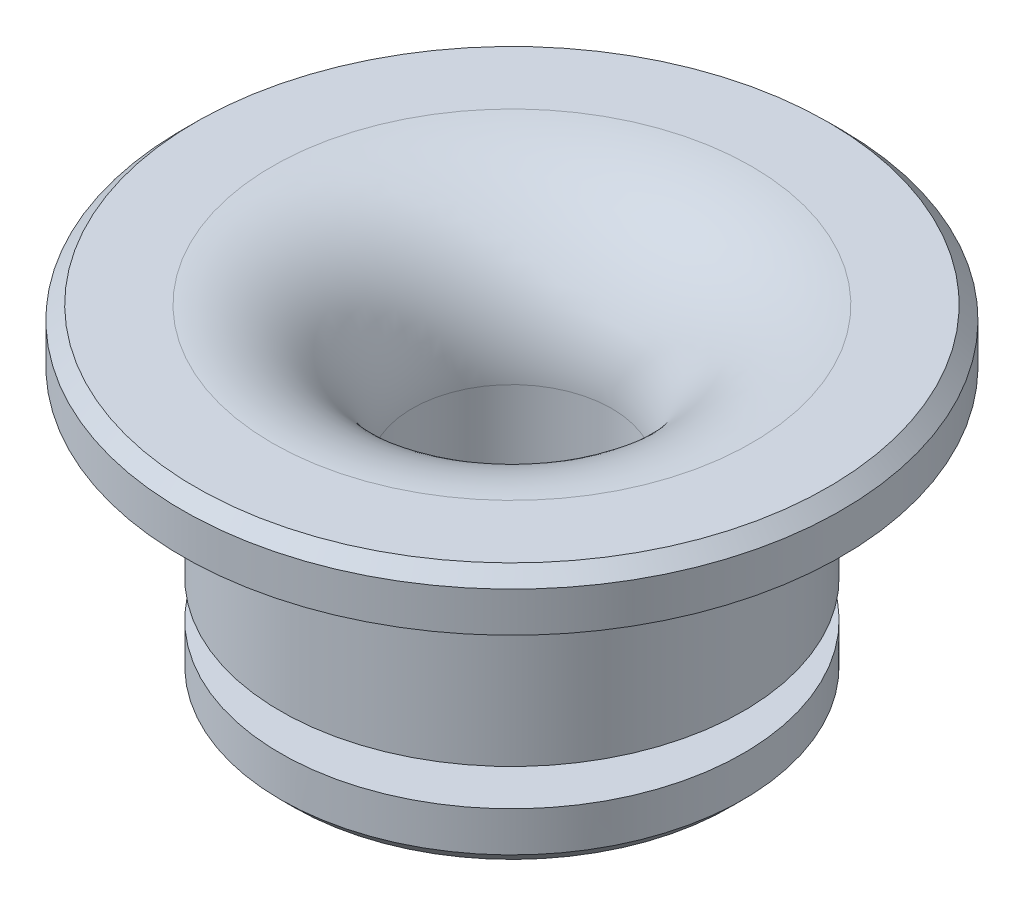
SolidWorks part; units mm, degrees
ref_plane "正面" through (0, 0, 0) normal (0, 0, 1) x (1, 0, 0)
ref_plane "平面" through (0, 0, 0) normal (0, 1, 0) x (1, 0, 0)
ref_plane "右側面" through (0, 0, 0) normal (1, 0, 0) x (0, 0, -1)
sketch "ｽｹｯﾁ2" plane through (0, 0, 0) normal (0, 0, 1) x (1, 0, 0)
  line L0 (-7.2, 0) -> (-9.9, 0)
  line L1 (-9.9, 0) -> (-9.9, -1.6)
  line L2 (-9.9, -1.6) -> (-6.95, -1.6)
  line L3 (-5, -7.1) -> (-5, -8.2)
  line L4 (-5, -8.2) -> (-6.95, -8.2)
  line L5 (-6.95, -8.2) -> (-6.95, -9.8)
  line L6 (-6.95, -9.8) -> (-3, -9.8)
  line L7 (0, -8) -> (0, 0) construction
  line L8 (-3, -4.2) -> (-3, -9.8)
  line L9 (-5, -7.1) -> (-6.95, -7.1)
  line L10 (-6.95, -7.1) -> (-6.95, -1.6)
  arc A0 (-7.2, 0) -> (-3, -4.2) centre (-7.2, -4.2) cw
  dimension "D9" = 7.2
  dimension "D1" = 9.9
  dimension "D2" = 1.6
  dimension "D3" = 9.8
  dimension "D4" = 1.6
  dimension "D5" = 5
  dimension "D6" = 3
  dimension "D7" = 6.95
  dimension "D8" = 1.1
revolve "回転1" add sketch "ｽｹｯﾁ2" angle 360 about L7
chamfer "面取り1" distance 0.4 angle 45 2 edges at (0, -9.8, -6.95) (0, -9.8, -3)
chamfer "面取り2" distance 0.4 angle 45 1 edges at (0, 0, -9.9)
